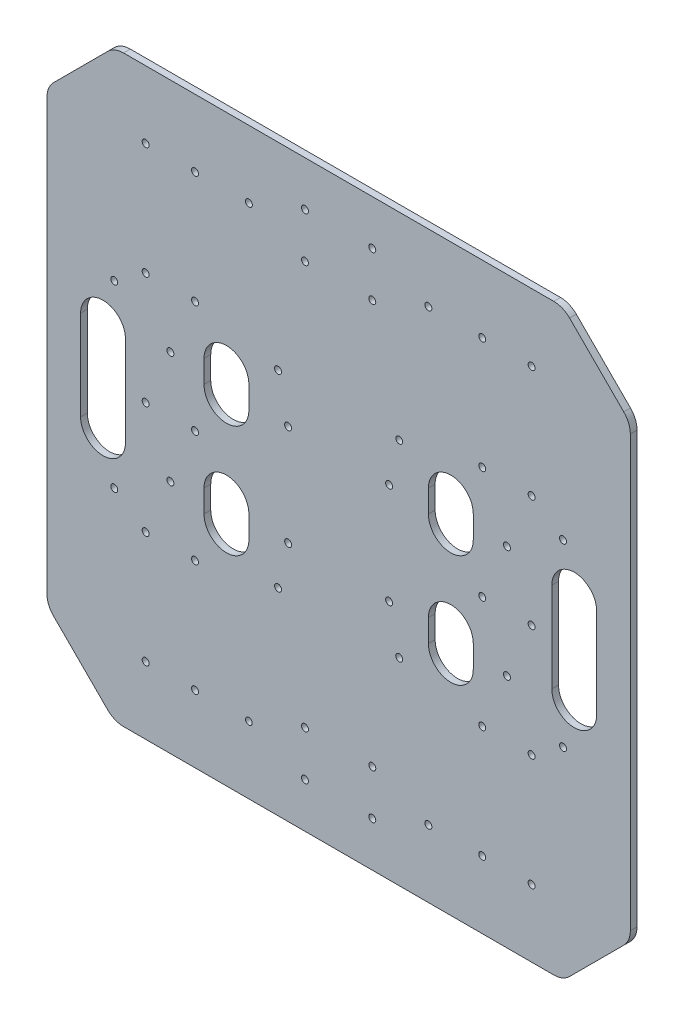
SolidWorks part; units mm, degrees
ref_plane "前视基准面" through (0, 0, 0) normal (0, 0, 1) x (1, 0, 0)
ref_plane "上视基准面" through (0, 0, 0) normal (0, 1, 0) x (1, 0, 0)
ref_plane "右视基准面" through (0, 0, 0) normal (1, 0, 0) x (0, 0, -1)
other "Configuration Table"
sketch "草图1" plane through (0, 0, 0) normal (0, 0, 1) x (1, 0, 0)
  line L1 (-130, 130) -> (130, 130) construction
  line L2 (-130, 130) -> (-130, -130) construction
  line L3 (-130, -130) -> (130, -130) construction
  line L4 (130, 130) -> (130, -130) construction
  line L5 (-130, 130) -> (130, -130) construction
  line L6 (-130, -130) -> (130, 130) construction
  line L8 (-130, 100) -> (-100, 130)
  line L9 (-100, 130) -> (100, 130)
  line L10 (100, 130) -> (130, 100)
  line L11 (130, 100) -> (130, -100)
  line L12 (130, -100) -> (100, -130)
  line L13 (100, -130) -> (-100, -130)
  line L14 (-100, -130) -> (-130, -100)
  line L15 (-130, -100) -> (-130, 100)
  point P0 (0, 0)
extrude "凸台-拉伸1" add sketch "草图1" along normal blind 3
sketch "草图2" plane through (0, 0, 0) normal (0, 0, -1) x (-1, 0, 0)
  line L1 (-75, 100) -> (75, 100) construction
  line L2 (-75, 100) -> (-75, -100) construction
  line L3 (-75, -100) -> (75, -100) construction
  line L4 (75, 100) -> (75, -100) construction
  line L5 (-75, 100) -> (75, -100) construction
  line L6 (-75, -100) -> (75, 100) construction
  point P0 (0, 0)
sketch "草图3" plane through (0, 0, 3) normal (0, 0, 1) x (1, 0, 0)
  line L0 (-86, 100) -> (-64, 100) construction
  line L1 (75, 100) -> (-75, 100) construction
  line L2 (86, 100) -> (64, 100) construction
  line L3 (-86, -100) -> (-64, -100) construction
  line L4 (75, -100) -> (-75, -100) construction
  line L5 (64, -100) -> (86, -100) construction
  line L6 (-75, 100) -> (-75, -100) construction
  line L7 (75, 100) -> (75, -100) construction
  line L8 (-40, 100) -> (40, 100) construction
  line L9 (-100, -100) -> (100, -100) construction
  line L10 (-100, -100) -> (-100, 100) construction
  line L11 (-100, 100) -> (100, 100) construction
  line L12 (100, -100) -> (100, 100) construction
  line L13 (-100, -100) -> (100, 100) construction
  line L14 (-100, 100) -> (100, -100) construction
  line L15 (-100, 40) -> (-100, -40) construction
  line L16 (100, 40) -> (100, -40) construction
  line L17 (-40, -100) -> (40, -100) construction
  line L18 (0, 115) -> (0, 85) construction
  line L19 (-90, 85) -> (90, 85) construction
  line L20 (0, -100) -> (0, -85) construction
  line L21 (-75, 100) -> (-75, 25) construction
  line L22 (-75, -100) -> (-75, -25) construction
  circle A0 centre (-86, 100) radius 1.55
  circle A1 centre (-64, 100) radius 1.55
  circle A2 centre (64, 100) radius 1.55
  circle A3 centre (86, 100) radius 1.55
  circle A5 centre (-86, -100) radius 1.55
  circle A6 centre (-64, -100) radius 1.55
  circle A7 centre (64, -100) radius 1.55
  circle A8 centre (86, -100) radius 1.55
  circle A11 centre (-40, 100) radius 1.55
  circle A12 centre (40, 100) radius 1.55
  circle A13 centre (100, 40) radius 1.55
  circle A14 centre (100, -40) radius 1.55
  circle A15 centre (40, -100) radius 1.55
  circle A16 centre (-40, -100) radius 1.5
  circle A17 centre (-100, -40) radius 1.55
  circle A18 centre (-100, 40) radius 1.55
  circle A19 centre (-90, 85) radius 1.55 construction
  circle A20 centre (90, 85) radius 1.55 construction
  circle A21 centre (-90, -85) radius 1.55 construction
  circle A22 centre (90, -85) radius 1.55 construction
  circle A23 centre (-86, 50) radius 1.55
  circle A24 centre (-64, 50) radius 1.55
  circle A25 centre (-86, -50) radius 1.55
  circle A26 centre (-64, -50) radius 1.55
  circle A27 centre (-86, 0) radius 1.55
  circle A28 centre (-64, 0) radius 1.55
  circle A29 centre (64, 50) radius 1.55
  circle A30 centre (86, 50) radius 1.55
  circle A31 centre (64, 0) radius 1.55
  circle A32 centre (86, 0) radius 1.55
  circle A33 centre (64, -50) radius 1.55
  circle A34 centre (86, -50) radius 1.55
  circle A35 centre (-75, 25) radius 1.55
  circle A36 centre (-75, -25) radius 1.55
  circle A38 centre (75, -25) radius 1.55
  circle A39 centre (75, 25) radius 1.55
  point P6 (-75, 100)
  point P13 (75, 100)
  point P23 (-75, -100)
  point P30 (75, -100)
  point P36 (0, 0)
  point P45 (0, 100)
  point P48 (-100, 0)
  point P51 (100, 0)
  point P54 (0, -100)
  point P66 (0, 100)
  point P68 (0, 85)
extrude "机架安装孔" cut sketch "草图3" against normal through all
sketch "草图5" plane through (0, 0, 3) normal (0, 0, 1) x (1, 0, 0)
  line L6 (-22.5, 22.5) -> (22.5, 22.5) construction
  line L7 (-22.5, 22.5) -> (-22.5, -22.5) construction
  line L8 (-22.5, -22.5) -> (22.5, -22.5) construction
  line L9 (22.5, 22.5) -> (22.5, -22.5) construction
  line L10 (-22.5, 22.5) -> (22.5, -22.5) construction
  line L11 (-22.5, -22.5) -> (22.5, 22.5) construction
  line L12 (-27, 42) -> (27, 42) construction
  line L13 (-27, 42) -> (-27, -42) construction
  line L14 (-27, -42) -> (27, -42) construction
  line L15 (27, 42) -> (27, -42) construction
  line L16 (-27, 42) -> (27, -42) construction
  line L17 (-27, -42) -> (27, 42) construction
  circle A0 centre (-22.5, 22.5) radius 1.55
  circle A1 centre (22.5, 22.5) radius 1.55
  circle A2 centre (-22.5, -22.5) radius 1.55
  circle A3 centre (22.5, -22.5) radius 1.55
  circle A4 centre (-27, 42) radius 1.55
  circle A5 centre (27, 42) radius 1.5
  circle A6 centre (27, -42) radius 1.55
  circle A7 centre (-27, -42) radius 1.55
  point P0 (0, 0)
  point P10 (0, 0)
extrude "飞控及电脑孔" cut sketch "草图5" against normal through all contours A4 | A0 | A5 | A1 | A2 | A3 | A6 | A7
sketch "草图6" plane through (0, 0, 3) normal (0, 0, 1) x (1, 0, 0)
  line L0 (-15, -110) -> (15, -110) construction
  line L1 (100, 130) -> (-100, 130) construction
  line L2 (-100, -130) -> (100, -130) construction
  line L3 (0, 130) -> (0, 110)
  line L4 (-15, 110) -> (15, 110) construction
  line L5 (0, 110) -> (0, 90) construction
  line L6 (-15, 90) -> (15, 90) construction
  line L7 (0, -130) -> (0, -90) construction
  line L8 (-15, -90) -> (15, -90) construction
  circle A0 centre (-15, 110) radius 1.55
  circle A1 centre (15, 110) radius 1.55
  circle A2 centre (-15, 90) radius 1.55
  circle A3 centre (15, 90) radius 1.55
  circle A4 centre (-15, -90) radius 1.55
  circle A5 centre (15, -90) radius 1.55
  circle A6 centre (-15, -110) radius 1.55
  circle A7 centre (15, -110) radius 1.55
  point P10 (0, 110)
  point P16 (0, 90)
  point P22 (0, -110)
  point P25 (0, -90)
extrude "扩展孔位" cut sketch "草图6" against normal through all contours A0 | A1 | A2 | A3 | A4 | A5 | A6 | A7
sketch "草图8" plane through (0, 0, 3) normal (0, 0, 1) x (1, 0, 0)
  line L0 (-50, 20) -> (-50, 30) construction
  line L1 (-60, 20) -> (-60, 30)
  line L2 (-40, 20) -> (-40, 30)
  line L3 (50, 20) -> (50, 30) construction
  line L4 (40, 20) -> (40, 30)
  line L5 (60, 20) -> (60, 30)
  line L6 (50, -30) -> (50, -20) construction
  line L7 (40, -30) -> (40, -20)
  line L8 (60, -30) -> (60, -20)
  line L9 (-50, -30) -> (-50, -20) construction
  line L10 (-60, -30) -> (-60, -20)
  line L11 (-40, -30) -> (-40, -20)
  line L12 (-105, 20) -> (-105, -20) construction
  line L15 (-95, 20) -> (-95, -20)
  line L20 (-115, 20) -> (-115, -20)
  line L23 (0, 100) -> (0, -100)
  line L26 (75, 100) -> (-75, 100) construction
  line L27 (75, -100) -> (-75, -100) construction
  line L28 (105, 20) -> (105, -20) construction
  line L29 (95, 20) -> (95, -20)
  line L30 (115, 20) -> (115, -20)
  arc A0 (-60, 20) -> (-40, 20) centre (-50, 20) ccw
  arc A1 (-40, 30) -> (-60, 30) centre (-50, 30) ccw
  arc A2 (40, 20) -> (60, 20) centre (50, 20) ccw
  arc A3 (60, 30) -> (40, 30) centre (50, 30) ccw
  arc A4 (40, -30) -> (60, -30) centre (50, -30) ccw
  arc A5 (60, -20) -> (40, -20) centre (50, -20) ccw
  arc A6 (-60, -30) -> (-40, -30) centre (-50, -30) ccw
  arc A7 (-40, -20) -> (-60, -20) centre (-50, -20) ccw
  arc A18 (-95, 20) -> (-115, 20) centre (-105, 20) ccw
  arc A19 (-115, -20) -> (-95, -20) centre (-105, -20) ccw
  arc A20 (95, 20) -> (115, 20) centre (105, 20) cw
  arc A21 (115, -20) -> (95, -20) centre (105, -20) cw
  point P2 (-50, 25)
  point P11 (50, 25)
  point P18 (50, -25)
  point P25 (-50, -25)
  point P30 (-105, 0)
  point P43 (105, 0)
  dimension "D1" = 20
  dimension "D2" = 10
  dimension "D3" = 2
  dimension "D4" = 2
extrude "减重孔" cut sketch "草图8" against normal through all
sketch "草图9" [suppressed] plane through (0, 0, 3) normal (0, 0, 1) x (1, 0, 0)
  line L0 (-130, 100) -> (-130, -100) construction
  line L3 (130, -100) -> (130, 100) construction
  line L4 (-120, 12) -> (-100, 12) construction
  line L5 (-120, 12) -> (-120, -12) construction
  line L6 (-120, -12) -> (-100, -12) construction
  line L7 (-100, 12) -> (-100, -12) construction
  line L8 (-120, 12) -> (-100, -12) construction
  line L9 (-120, -12) -> (-100, 12) construction
  line L10 (120, 12) -> (100, 12) construction
  line L11 (120, 12) -> (120, -12) construction
  line L12 (120, -12) -> (100, -12) construction
  line L13 (100, 12) -> (100, -12) construction
  line L14 (120, 12) -> (100, -12) construction
  line L15 (120, -12) -> (100, 12) construction
  circle A0 centre (-120, 12) radius 1.55
  circle A1 centre (-100, 12) radius 1.55
  circle A2 centre (-100, -12) radius 1.55
  circle A3 centre (-120, -12) radius 1.55
  circle A4 centre (100, 12) radius 1.55
  circle A5 centre (120, 12) radius 1.55
  circle A6 centre (120, -12) radius 1.55
  circle A7 centre (100, -12) radius 1.55
  point P2 (110, 0)
  point P6 (-110, 0)
  dimension "D1" = 20
  dimension "D2" = 20
fillet "圆角1" radius 10 8 edges at (-130, -100, 1.5) (-100, -130, 1.5) (100, -130, 1.5) (130, -100, 1.5) (130, 100, 1.5) (100, 130, 1.5) (-100, 130, 1.5) (-130, 100, 1.5)
